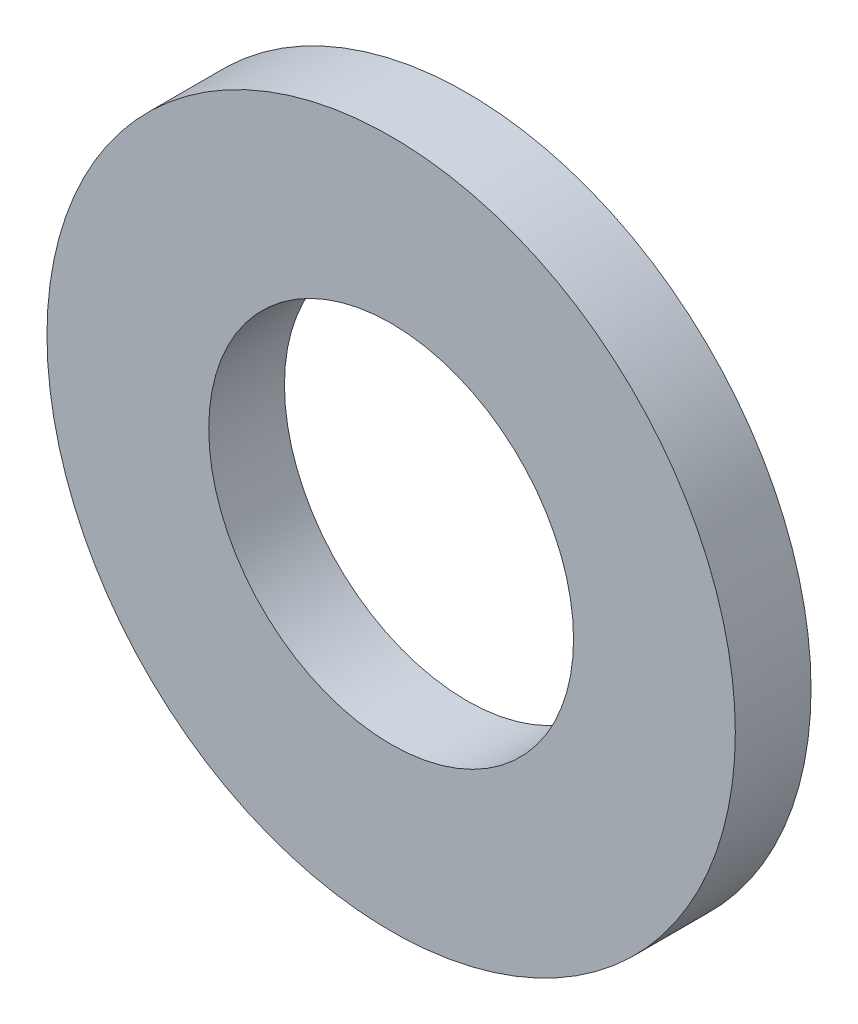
SolidWorks part; units mm, degrees
ref_plane "Front Plane" through (0, 0, 0) normal (0, 0, 1) x (1, 0, 0)
ref_plane "Top Plane" through (0, 0, 0) normal (0, 1, 0) x (1, 0, 0)
ref_plane "Right Plane" through (0, 0, 0) normal (1, 0, 0) x (0, 0, -1)
sketch "Sketch1" plane through (0, 0, 0) normal (0, 0, 1) x (1, 0, 0)
  circle A0 centre (0, 0) radius 5
  circle A1 centre (0, 0) radius 2.65
  dimension "OD" = 10
  dimension "ID1" = 5.3
extrude "Boss-Extrude1" add sketch "Sketch1" along normal blind 1.1
